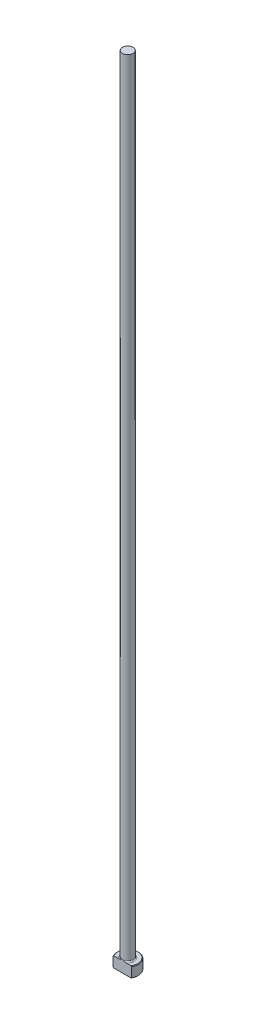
SolidWorks part; units mm, degrees
ref_plane "Front Plane" through (0, 0, 0) normal (0, 0, 1) x (1, 0, 0)
ref_plane "Top Plane" through (0, 0, 0) normal (0, 1, 0) x (1, 0, 0)
ref_plane "Right Plane" through (0, 0, 0) normal (1, 0, 0) x (0, 0, -1)
sketch "Sketch1" plane through (0, 0, 0) normal (0, 0, 1) x (1, 0, 0)
  line L0 (0, 259.9588) -> (0, -15.1925) construction
  line L1 (0, 0) -> (-4.7625, 0)
  line L2 (-4.7625, 0) -> (-4.7625, 4.7498)
  line L3 (-4.7625, 4.7498) -> (-2.3812, 4.7498)
  line L4 (-2.3812, 4.7498) -> (-2.3812, 355.6)
  line L5 (-2.3812, 355.6) -> (0, 355.6)
  line L6 (0, 355.6) -> (0, 0)
  dimension "L" = 355.6
  dimension "H" = 9.525
  dimension "T" = 4.7498
  dimension "D" = 4.7625
revolve "Revolve1" add sketch "Sketch1" angle 360 about L0
chamfer "Chamfer1" distance 0.254 angle 45 2 edges at (0, 4.7498, 4.7625) (0, 0, 4.7625)
fillet "Fillet1" radius 0.508 1 edges at (0, 4.7498, 2.3812)
sketch "Sketch2" plane through (0, 0, 0) normal (0, -1, 0) x (1, 0, 0)
  line L0 (-4.1244, 2.3812) -> (4.1244, 2.3812)
  arc A0 (4.1244, 2.3812) -> (-4.1244, 2.3812) centre (0, 0) ccw
  circle A1 centre (0, 0) radius 4.7625 construction
  circle A3 centre (0, 0) radius 2.3812 construction
extrude "KEY" cut sketch "Sketch2" against normal through all
sketch "Pocket Sketch" plane through (0, 0, 0) normal (0, 0, 1) x (1, 0, 0)
  line L0 (-5.1594, 0) -> (-5.1594, 4.7752)
  line L1 (-5.1594, 4.7752) -> (-3.3417, 4.7752)
  line L2 (-2.5797, 5.5372) -> (-2.5797, 22.225)
  line L3 (-2.5797, 22.225) -> (0, 22.225)
  line L4 (0, 22.225) -> (0, 0)
  line L5 (0, 0) -> (-5.1594, 0)
  line L6 (0, 12.6104) -> (0, -2.4989) construction
  line L7 (-4.7625, 4.4958) -> (-4.7625, 0.254) construction
  line L8 (4.5085, 4.7498) -> (-4.5085, 4.7498) construction
  line L9 (-2.3812, 355.6) -> (-2.3812, 5.2578) construction
  line L10 (-3.3417, 4.7752) -> (-2.5797, 5.5372)
  point P3 (-2.5797, 4.7752)
  dimension "D1" = 10.3187
  dimension "D2" = 0.3969
  dimension "D3" = 0.0254
  dimension "D4" = 0.1984
  dimension "D5" = 5.1594
  dimension "D6" = 22.225
